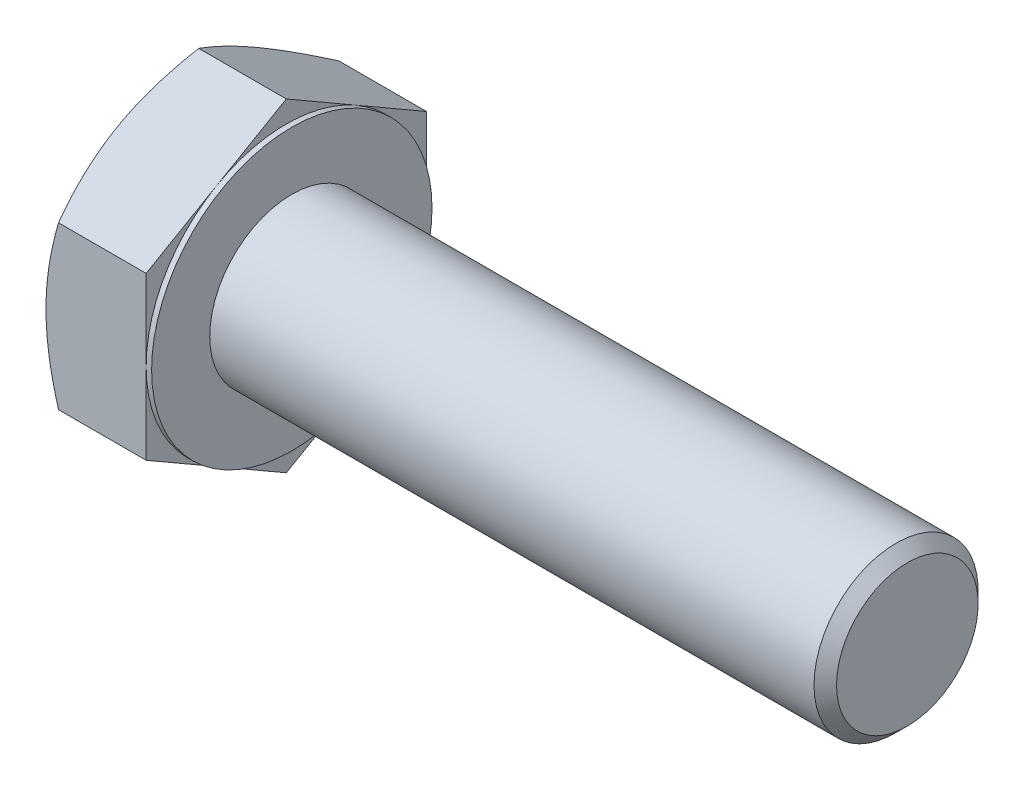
SolidWorks part; units mm, degrees
extrude "BaseHead" add sketch "Sketch1" along normal blind 15.44
sketch "Sketch1" plane through (0, 0, 0) normal (1, 0, 0) x (0, 0, -1)
  line L0 (20.5, 11.8357) -> (20.5, -11.8357)
  line L1 (-20.5, 11.8357) -> (-20.5, -11.8357)
  line L2 (20.5, -11.8357) -> (0, -23.6714)
  line L3 (0, -23.6714) -> (-20.5, -11.8357)
  line L4 (20.5, 11.8357) -> (0, 23.6714)
  line L5 (0, 23.6714) -> (-20.5, 11.8357)
revolve "HeadChamfer" cut sketch "Sketch3" angle 360 about L6
sketch "Sketch3" plane through (0, 0, 0) normal (0, 0, 1) x (1, 0, 0)
  line L0 (0, 20.5) -> (4.7177, 28.6714)
  line L1 (0, 23.6714) -> (0, 11.8357) construction
  line L2 (4.7177, 28.6714) -> (4.7177, 33.6714)
  line L3 (4.7177, 33.6714) -> (-10, 33.6714)
  line L4 (-10, 33.6714) -> (-10, 20.5)
  line L5 (-10, 20.5) -> (0, 20.5)
  line L6 (0, 0) -> (99.06, 0) construction
  line L7 (15.44, 23.6714) -> (0, 23.6714) construction
ref_plane "Plane1" through (0, 0, 0) normal (0, 0, 1) x (1, 0, 0)
ref_plane "Plane2" through (0, 0, 0) normal (0, 1, 0) x (1, 0, 0)
ref_plane "Plane3" through (0, 0, 0) normal (1, 0, 0) x (0, 0, -1)
sketch "BodySke" plane through (0, 0, 0) normal (0, 0, 1) x (1, 0, 0)
  line L0 (0, 11.8357) -> (0, -11.8357) construction
  line L1 (0, 0) -> (105.44, 0)
  line L2 (0, 0) -> (0, 12)
  line L3 (0, 12) -> (103.792, 12)
  line L4 (105.44, 0) -> (105.44, 10.352)
  line L5 (15.44, 23.6714) -> (15.44, 11.8357) construction
  line L6 (105.44, 10.352) -> (103.792, 12)
  line L7 (0, 0) -> (96.52, 0) construction
  line L8 (105.44, -10.352) -> (103.792, -12) construction
  line L9 (0, -12) -> (103.792, -12) construction
  line L10 (18.44, 15.24) -> (18.44, -1.27) construction
  line L11 (51.44, 15.24) -> (51.44, -1.27) construction
  line L12 (15.44, 11.8357) -> (15.44, -11.8357) construction
revolve "BaseBody" add sketch "BodySke"
fillet "HeadFillet" [suppressed] radius 0.8
sketch "Sketch4" plane through (0, 0, 0) normal (0, 0, 1) x (1, 0, 0)
  line L1 (15.44, 23.6714) -> (15.44, 11.8357) construction
  line L2 (15.44, 20.5) -> (14.64, 20.5)
  line L3 (15.44, 20.5) -> (15.44, 33.6714)
  line L4 (15.44, 33.6714) -> (14.64, 33.6714)
  line L5 (0, 0) -> (95.25, 0) construction
  line L6 (0, 0) -> (96.52, 0) construction
  line L7 (14.64, 20.5) -> (14.64, 33.6714)
  line L8 (15.44, 23.6714) -> (1.831, 23.6714) construction
revolve "BearingFace" cut sketch "Sketch4" angle 360 about L5
sketch "ThdSchSke" plane through (0, 0, 0) normal (0, 0, 1) x (1, 0, 0)
  line L0 (51.44, -10.352) -> (50.2861, -12)
  line L1 (51.44, -10.352) -> (52.5939, -12)
  line L2 (52.5939, -12) -> (52.5939, -15)
  line L3 (-3.175, 0) -> (5.1513, 0) construction
  line L5 (52.5939, -15) -> (50.2861, -15)
  line L6 (50.2861, -15) -> (50.2861, -12)
revolve "ThreadSchematic" [suppressed] cut sketch "ThdSchSke" angle 360 about L3
pattern_linear "ThdSchPat" [suppressed]
equation "\"D3@Sketch1\" = \"Width_flats@Sketch1\" / 2"
equation "\"D4@Sketch1\" = \"D3@Sketch1\""
equation "\"D5@Sketch1\" = \"D4@Sketch1\""
equation "\"Thread_minor@ThreadCosmetic\" = \"Minor_dia@BodySke\""
equation "\"D1@Sketch3\" = \"Width_flats@Sketch1\" / 2"
equation "\"D1@Sketch4\" = \"Width_flats@Sketch1\""
equation "\"Thread_length@ThreadCosmetic\" = ((sgn( (\"Length@BodySke\" - \"Advance@BodySke\" ) - \"Thread_nom@BodySke\" )-1)*( (\"Length@BodySke\" - \"Advance@BodySke\" ) - \"Thread_nom@BodySke\" ))/-2+ \"Thread_nom@BodySke\""
equation "\"Thread_minor@ThdSchSke\" = \"Minor_dia@BodySke\""
equation "\"Diameter@ThdSchSke\" = \"Diameter@BodySke\""
equation "\"Overcut@ThdSchSke\" = \"Diameter@BodySke\" * 1.25"
equation "\"Start@ThdSchSke\" = \"Head_ht@BaseHead\" + \"Length@BodySke\" - \"Thread_length@ThreadCosmetic\"  '---Non-countersunk---"
equation "\"Num_threads@ThdSchPat\" = int( \"Thread_length@ThreadCosmetic\" / \"Advance@BodySke\" + 0.999 )  + 1"
equation "\"Advance@ThdSchPat\" = \"Thread_length@ThreadCosmetic\" /  (\"Num_threads@ThdSchPat\" - 1) 'relax it"
equation "\"Num_threads@ThdSchPat\" = \"Num_threads@ThdSchPat\" - sgn( \"Num_threads@ThdSchPat\" - 1) '---chamfered tips only---"
